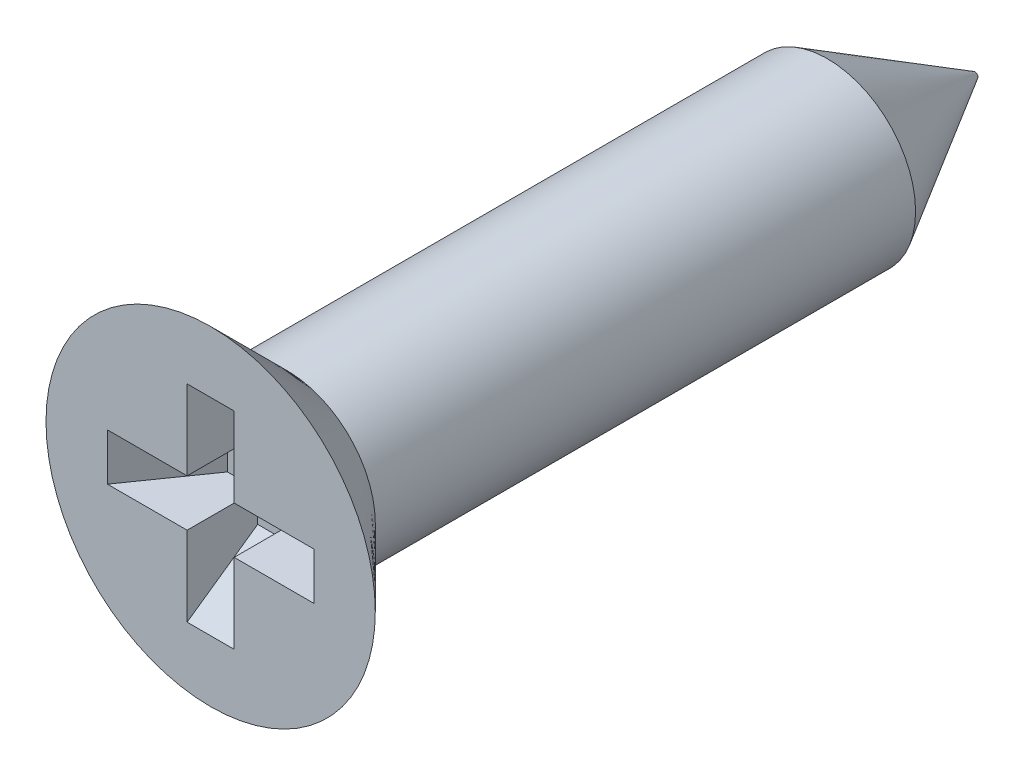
SolidWorks part; units mm, degrees
ref_plane "Plan de face" through (0, 0, 0) normal (0, 0, 1) x (1, 0, 0)
ref_plane "Plan de dessus" through (0, 0, 0) normal (0, 1, 0) x (1, 0, 0)
ref_plane "Plan de droite" through (0, 0, 0) normal (1, 0, 0) x (0, 0, -1)
sketch "Esquisse1" plane through (0, 0, 0) normal (1, 0, 0) x (0, 0, -1)
  line L0 (-1.6035, 0) -> (7.1529, 0) construction
  line L1 (0, 5.0438) -> (0, -4.594) construction
  line L2 (0, 2.8) -> (1.3, 1.5)
  line L3 (1.3, 1.5) -> (1.3, 0)
  line L4 (-1.442, 2.8) -> (2.7621, 2.8) construction
  line L5 (0, 2.8) -> (8.0274, -5.2274) construction
  line L6 (-1.0988, 1.5) -> (4.1029, 1.5) construction
  line L7 (1.3, 0) -> (0, 0)
  line L9 (0, 2.8) -> (0, 0)
revolve "Révolution2" add sketch "Esquisse1" angle 360 about L0
sketch "Esquisse3" plane through (0, 0, 0) normal (0, 0, 1) x (1, 0, 0)
  circle A0 centre (0, 0) radius 1.5
extrude "Extrusion1" add sketch "Esquisse3" against normal blind 13
sketch "Esquisse2" plane through (0, 0, 0) normal (0, 0, 1) x (1, 0, 0)
  line L0 (0.4, -0.4) -> (1.755, -0.4)
  line L1 (0.4, 0.4) -> (1.755, 0.4)
  line L2 (-1.755, -0.4) -> (-0.4, -0.4)
  line L3 (-0.4, 1.755) -> (-0.4, 0.4)
  line L4 (-1.755, 0.4) -> (-0.4, 0.4)
  line L5 (0.4, 1.755) -> (0.4, 0.4)
  line L6 (-0.4, 1.755) -> (0.4, 1.755)
  line L7 (1.755, 0.4) -> (1.755, -0.4)
  line L8 (0.4, -1.755) -> (-0.4, -1.755)
  line L9 (-1.755, -0.4) -> (-1.755, 0.4)
  line L10 (-0.4, -0.4) -> (-0.4, -1.755)
  line L12 (0.4, -0.4) -> (0.4, -1.755)
  circle A0 centre (0, 0) radius 1.8 construction
extrude "Enlèv. mat.-Extru.2" cut sketch "Esquisse2" against normal blind 1.2
draft "Dépouille3" type of draft neutral plane draft angle 35 faces to draft 4 parameters "D1"=35
chamfer "Chanfrein1" distance 1.45 angle 60 1 edges at (1.5, 0, -13)
